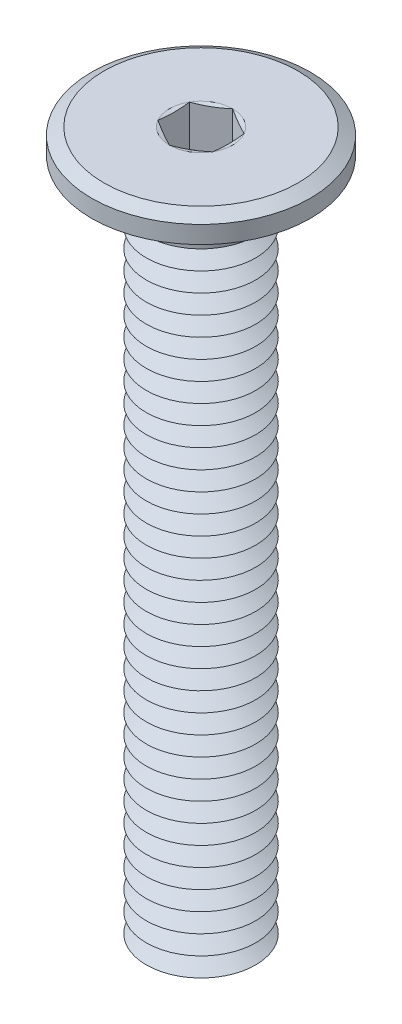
SolidWorks part; units mm, degrees
ref_plane "Front Plane" through (0, 0, 0) normal (0, 0, 1) x (1, 0, 0)
ref_plane "Top Plane" through (0, 0, 0) normal (0, 1, 0) x (1, 0, 0)
ref_plane "Right Plane" through (0, 0, 0) normal (1, 0, 0) x (0, 0, -1)
sketch "Sketch1" plane through (0, 0, 0) normal (0, 1, 0) x (1, 0, 0)
  circle A0 centre (0, 0) radius 4
  dimension "D1" = 8
extrude "Boss-Extrude1" add sketch "Sketch1" against normal blind 0.9
sketch "Sketch2" plane through (0, -0.9, 0) normal (0, -1, 0) x (1, 0, 0)
  circle A0 centre (0, 0) radius 2
  dimension "D1" = 4
extrude "Boss-Extrude2" add sketch "Sketch2" along normal blind 25
sketch "Sketch3" plane through (0, 0, 0) normal (1, 0, 0) x (0, 0, -1)
  line L0 (0, 0.9906) -> (0, -8.2999) construction
sketch "Sketch5" plane through (0, 0, 0) normal (1, 0, 0) x (0, 0, -1)
  line L0 (-2, -26.25) -> (-1.3938, -25.9)
  line L1 (-2, -0.9) -> (-2, -25.9) construction
  line L2 (-1.3938, -25.9) -> (-2, -25.55)
  line L3 (-2, -0.9) -> (-2, -25.9) construction
  line L4 (-2, -25.55) -> (-2, -26.25)
  line L6 (-2, -0.9) -> (-2, -25.9) construction
  line L7 (-2, -0.9) -> (-2, -25.9) construction
  line L14 (-2, -25.9) -> (2, -25.9) construction
  dimension "D1" = 0.7
revolve "Cut-Revolve1" cut sketch "Sketch5" angle 360 about L0
pattern_linear "LPattern1" count 34 spacing 0.7 along (0, 1, 0) of "Cut-Revolve1"
fillet "Fillet1" radius 0.2 1 edges at (0, -0.9, -2)
chamfer "Chamfer2" distance 0.45 angle 30 1 edges at (0, 0, 4)
sketch "Sketch6" plane through (0, 0, 0) normal (0, 1, 0) x (1, 0, 0)
  line L1 (0, 1.1547) -> (-1, 0.5774)
  line L2 (-1, 0.5774) -> (-1, -0.5774)
  line L3 (-1, -0.5774) -> (0, -1.1547)
  line L4 (0, -1.1547) -> (1, -0.5774)
  line L5 (1, -0.5774) -> (1, 0.5774)
  line L6 (1, 0.5774) -> (0, 1.1547)
  circle A0 centre (0, 0) radius 1 construction
  dimension "D1" = 2
extrude "Cut-Extrude1" cut sketch "Sketch6" against normal blind 1.5
sketch "Sketch7" plane through (0, -1.5, 0) normal (0, 1, 0) x (1, 0, 0)
  line L0 (-1, 0.5774) -> (-1, -0.5774) construction
  circle A0 centre (0, 0) radius 1
extrude "Cut-Extrude2" cut sketch "Sketch7" against normal through all draft 60
sketch "Sketch8" plane through (0, 0, 0) normal (0, 1, 0) x (1, 0, 0)
  circle A0 centre (0, 0) radius 1.1547
extrude "Cut-Extrude3" cut sketch "Sketch8" against normal through all draft 75
